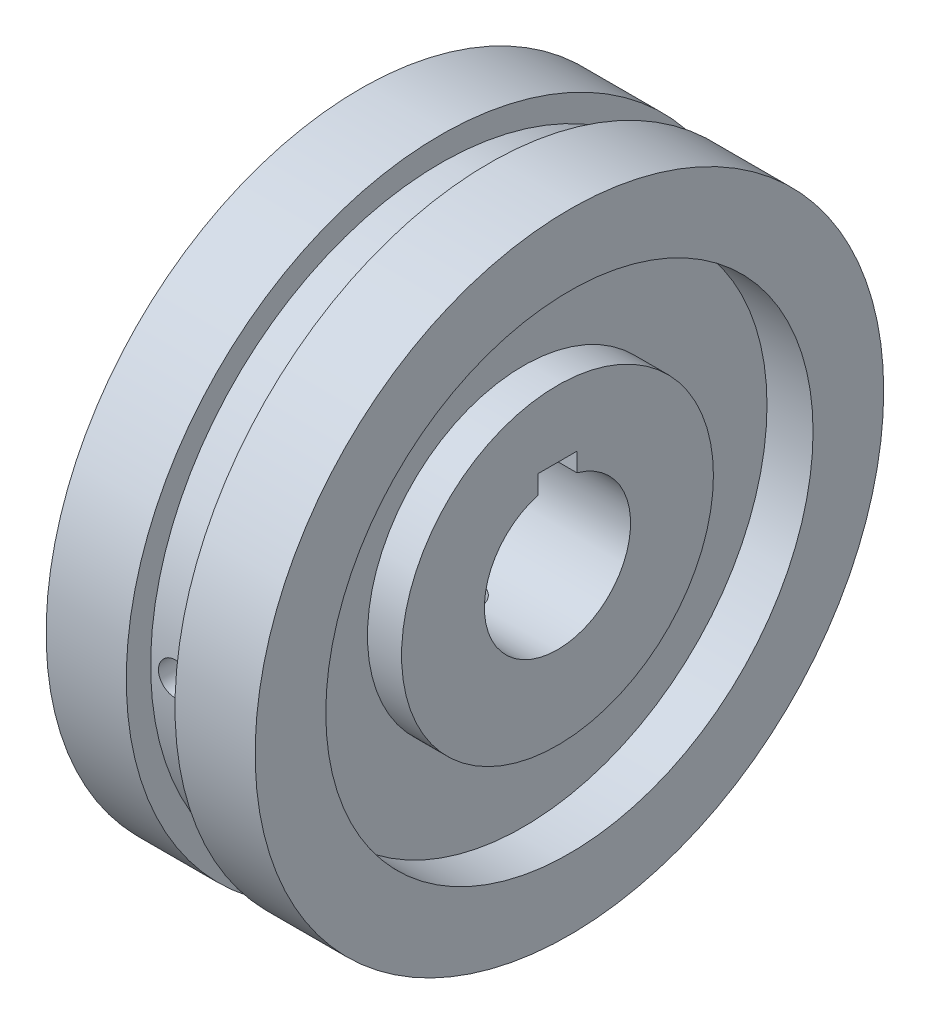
SolidWorks part; units mm, degrees
ref_plane "Plan de face" through (0, 0, 0) normal (0, 0, 1) x (1, 0, 0)
ref_plane "Plan de dessus" through (0, 0, 0) normal (0, 1, 0) x (1, 0, 0)
ref_plane "Plan de droite" through (0, 0, 0) normal (1, 0, 0) x (0, 0, -1)
sketch "Esquisse1" plane through (0, 0, 0) normal (0, 0, 1) x (1, 0, 0)
  line L0 (0, 0) -> (0, 73.4064) construction
  line L1 (19, 15) -> (-19, 15)
  line L2 (-19, 15) -> (-19, 32)
  line L3 (19, 15) -> (19, 32)
  line L4 (-21.45, 50) -> (-12, 50)
  line L5 (12, 50) -> (21.45, 50)
  line L6 (-21.45, 50) -> (-21.45, 64.5)
  line L7 (21.45, 50) -> (21.45, 64.5)
  line L8 (-21.45, 64.5) -> (-5, 64.5)
  line L9 (22.4457, 0) -> (-22.4457, 0) construction
  line L10 (5, 59.5) -> (5, 64.5)
  line L11 (5, 59.5) -> (-5, 59.5)
  line L12 (-5, 59.5) -> (-5, 64.5)
  line L13 (5, 64.5) -> (21.45, 64.5)
  line L14 (19, 32) -> (12, 32)
  line L15 (12, 32) -> (12, 50)
  line L16 (-12, 50) -> (-12, 32)
  line L17 (-12, 32) -> (-19, 32)
  point P6 (0, 15)
  dimension "D1" = 38
  dimension "D2" = 15
  dimension "D3" = 100
  dimension "D4" = 129
  dimension "D5" = 42.9
  dimension "D6" = 10
  dimension "D7" = 5
  dimension "D8" = 5
  dimension "D9" = 64
  dimension "D10" = 7
  dimension "D11" = 7
  dimension "D12" = 100
  dimension "D13" = 64
revolve "Révolution1" add sketch "Esquisse1" angle 360 about L9
sketch "Esquisse2" plane through (12, 0, 0) normal (1, 0, 0) x (0, 0, -1)
  line L1 (-4, 18.3) -> (4, 18.3)
  line L2 (-4, 18.3) -> (-4, 0)
  line L3 (-4, 0) -> (4, 0)
  line L4 (4, 18.3) -> (4, 0)
  circle A0 centre (0, 0) radius 15 construction
  dimension "D2" = 33.3
  dimension "D1" = 8
extrude "Enlèv. mat.-Extru.1" cut sketch "Esquisse2" against normal mid plane 70
hole_wizard "Trou taraudé M8x1.251" positions "Esquisse3D1" profile "Esquisse3" tap size "M8x1.25" standard "ISO"
sketch3d "Esquisse3D1"
  point P0 (0, -64.5, 0)
  point P1 (0, 0, 64.5)
sketch "Esquisse3" plane through (0, -64.5, 0) normal (1, 0, 0) x (0, 0, -1)
  line L0 (0, 0) -> (0, 49.5)
  line L1 (0, 49.5) -> (3.4, 49.5)
  line L2 (3.4, 49.5) -> (3.4, 0)
  line L5 (3.4, 0) -> (0, 0)
  line L11 (0, -6.35) -> (0, 107.95) construction
  dimension "Diamètre du trou pour taraudage jusqu'au prochain" = 6.8
  dimension "Profondeur du trou pour taraudage jusqu'au prochain" = 49.5
